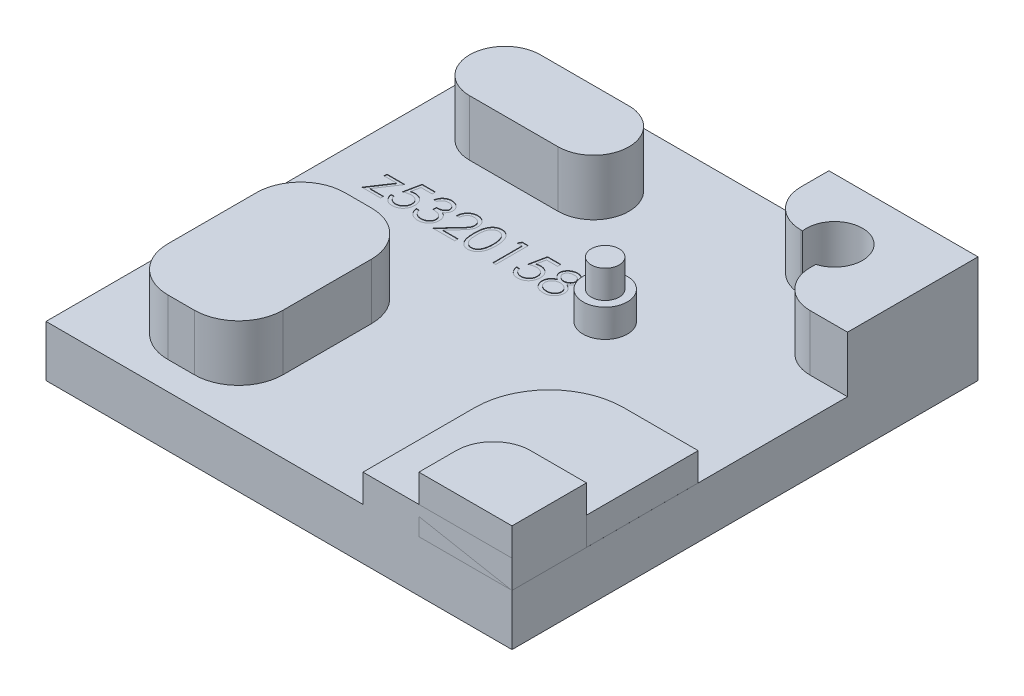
SolidWorks part; units mm, degrees
ref_plane "Front Plane" through (0, 0, 0) normal (0, 0, 1) x (1, 0, 0)
ref_plane "Top Plane" through (0, 0, 0) normal (0, 1, 0) x (1, 0, 0)
ref_plane "Right Plane" through (0, 0, 0) normal (1, 0, 0) x (0, 0, -1)
sketch "Sketch1" plane through (0, 0, 0) normal (0, 1, 0) x (1, 0, 0)
  line L1 (-22.6457, 20.9641) -> (27.3543, 20.9641)
  line L2 (-22.6457, 20.9641) -> (-22.6457, -29.0359)
  line L3 (-22.6457, -29.0359) -> (27.3543, -29.0359)
  line L4 (27.3543, 20.9641) -> (27.3543, -29.0359)
  dimension "D1" = 50
  dimension "D2" = 50
extrude "Boss-Extrude4" add sketch "Sketch1" along normal blind 5.5 contours L2 L3 L4 L1
sketch "Sketch5" plane through (0, 5.5, 0) normal (0, 1, 0) x (1, 0, 0)
  line L0 (17.3643, -29.0359) -> (17.3643, -25.0399)
  line L2 (21.3603, -21.0439) -> (27.3543, -21.0439)
  line L14 (17.3643, -29.0359) -> (27.3543, -29.0359)
  line L15 (27.3543, -29.0359) -> (27.3543, -21.0439)
  arc A0 (21.3603, -21.0439) -> (17.3643, -25.0399) centre (21.3603, -25.0399) ccw
sketch "Sketch6" plane through (0, 5.5, 0) normal (0, 1, 0) x (1, 0, 0)
  line L0 (11.3682, -29.0359) -> (11.3682, -17.0479)
  line L2 (19.3602, -9.0559) -> (27.3522, -9.0559)
  line L18 (27.3522, -29.0359) -> (27.3522, -9.0559)
  line L21 (11.3682, -29.0359) -> (27.3522, -29.0359)
  arc A0 (19.3602, -9.0559) -> (11.3682, -17.0479) centre (19.3602, -17.0479) ccw
sketch "Sketch7" plane through (0, 5.5, 0) normal (0, 1, 0) x (1, 0, 0)
  line L0 (-11.1457, -6.5359) -> (-11.1457, -26.5359) construction
  line L1 (-12.5707, -7.0359) -> (-9.7207, -7.0359)
  line L2 (-17.3207, -11.7859) -> (-17.3207, -21.2859)
  line L3 (-12.5707, -26.0359) -> (-9.7207, -26.0359)
  line L4 (-4.9707, -11.7859) -> (-4.9707, -21.2859)
  line L6 (-17.6457, -16.5359) -> (-4.6457, -16.5359) construction
  arc A0 (-12.5707, -26.0359) -> (-17.3207, -21.2859) centre (-12.5707, -21.2859) cw
  arc A1 (-9.7207, -26.0359) -> (-4.9707, -21.2859) centre (-9.7207, -21.2859) ccw
  arc A2 (-4.9707, -11.7859) -> (-9.7207, -7.0359) centre (-9.7207, -11.7859) ccw
  arc A3 (-12.5707, -7.0359) -> (-17.3207, -11.7859) centre (-12.5707, -11.7859) ccw
sketch "Sketch8" plane through (0, 5.5, 0) normal (0, 1, 0) x (1, 0, 0)
  line L0 (15.3543, 13.9641) -> (15.5333, 13.9641)
  line L1 (-15.1457, 16.4641) -> (-5.1457, 16.4641)
  line L3 (-15.1457, 8.4641) -> (-5.1457, 8.4641)
  line L4 (-22.6457, 20.9641) -> (27.3543, 20.9641) construction
  line L5 (-22.6457, 20.9641) -> (-22.6457, -29.0359) construction
  line L6 (11.3543, 20.9641) -> (11.3543, 17.9641)
  line L7 (27.3543, 20.9641) -> (27.3543, -29.0359) construction
  line L8 (19.3543, 11.5557) -> (19.3543, 10.9641)
  line L9 (23.3543, 6.9641) -> (27.3543, 6.9641)
  arc A0 (-5.1457, 16.4641) -> (-5.1457, 8.4641) centre (-5.1457, 12.4641) cw
  arc A1 (-15.1457, 16.4641) -> (-15.1457, 8.4641) centre (-15.1457, 12.4641) ccw
  arc A2 (11.3543, 17.9641) -> (15.3543, 13.9641) centre (15.3543, 17.9641) ccw
  arc A3 (19.3543, 10.9641) -> (23.3543, 6.9641) centre (23.3543, 10.9641) ccw
  arc A4 (15.5333, 13.9641) -> (19.3543, 11.5557) centre (18.4969, 14.4305) cw
  dimension "D5" = 14
  dimension "D9" = 8
  dimension "D10" = 4
  dimension "D7" = 3
  dimension "D11" = 4
  dimension "D1" = 8
  dimension "D2" = 10
  dimension "D3" = 4.5
  dimension "D4" = 7.5
  dimension "D6" = 16
  dimension "D8" = 7
sketch "Sketch9" plane through (0, 5.5, 0) normal (0, 1, 0) x (1, 0, 0)
  line L0 (-19.1457, 12.4641) -> (-1.1457, 12.4641) construction
  line L1 (-14.8957, 16.2641) -> (-5.3957, 16.2641)
  line L3 (-14.8957, 8.6641) -> (-5.3957, 8.6641)
  line L5 (-10.1457, 16.4641) -> (-10.1457, 8.4641) construction
  arc A0 (-5.3957, 16.2641) -> (-5.3957, 8.6641) centre (-5.3957, 12.4641) cw
  arc A1 (-14.8957, 16.2641) -> (-14.8957, 8.6641) centre (-14.8957, 12.4641) ccw
sketch "Sketch10" plane through (0, 5.5, 0) normal (0, 1, 0) x (1, 0, 0)
  circle A0 centre (7.3543, 0.9641) radius 2.375
extrude "Boss-Extrude27" add sketch "Sketch8" along normal blind 6 contours L0 A4 L8 A3 L9 L6 A2 M8 M9
extrude "Boss-Extrude29" add sketch "Sketch10" along normal blind 3 separate body contours A0
sketch "Sketch12" plane through (0, 8.5, 0) normal (0, 1, 0) x (1, 0, 0)
  circle A0 centre (7.3543, 0.9641) radius 1.4985
sketch "Sketch13" plane through (0, 5.5, 0) normal (0, 1, 0) x (1, 0, 0)
  text T0 "z5320158"
extrude "Cut-Extrude1" cut sketch "Sketch13" against normal blind 0.05
extrude "Boss-Extrude31" add sketch "Sketch7" along normal blind 6 separate body contours L2 A0 L3 A1 L4 A2 L1 A3
extrude "Boss-Extrude32" add sketch "Sketch9" along normal blind 6 contours L3 A0 L1 A1
extrude "Boss-Extrude38" add sketch "Sketch6" along normal blind 3 contours L0 A0 L2 L18 L21
extrude "Boss-Extrude39" add sketch "Sketch5" along normal blind 6 separate body contours A0 L0 L14 L15 L2
extrude "Boss-Extrude40" add sketch "Sketch12" along normal blind 3 contours A0
